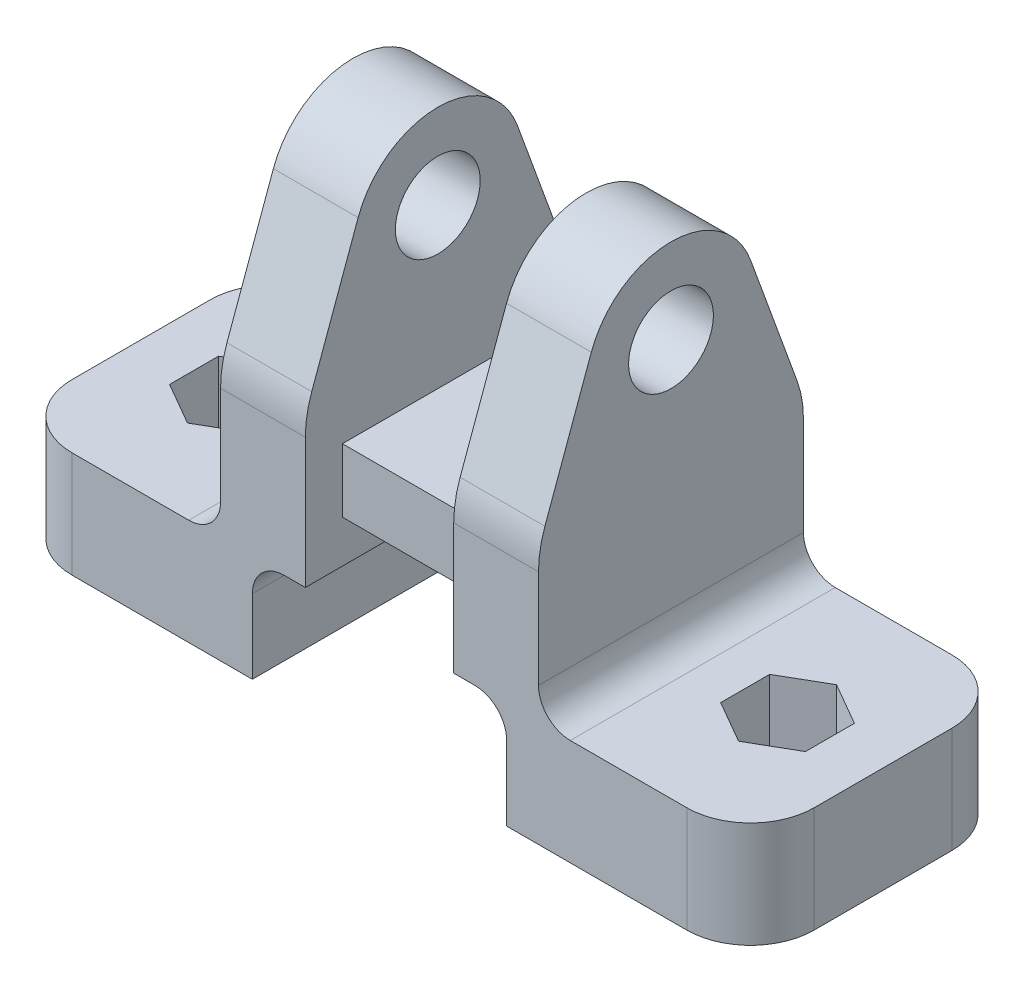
SolidWorks part; units mm, degrees
ref_plane "Alzado" through (0, 0, 0) normal (0, 0, 1) x (1, 0, 0)
ref_plane "Planta" through (0, 0, 0) normal (0, 1, 0) x (1, 0, 0)
ref_plane "Vista lateral" through (0, 0, 0) normal (1, 0, 0) x (0, 0, -1)
sketch "Croquis1" plane through (0, 0, 0) normal (1, 0, 0) x (0, 0, -1)
  line L0 (0, 10) -> (-25, 10)
  line L1 (-25, 10) -> (-25, 24.047)
  line L2 (-25, 24.047) -> (-20.0175, 37.7362)
  line L3 (0, 24.047) -> (0, 10)
  line L4 (0, 24.047) -> (-4.9825, 37.7362)
  arc A1 (-4.9825, 37.7362) -> (-20.0175, 37.7362) centre (-12.5, 35) ccw
  dimension "D1" = 10
  dimension "D3" = 8
  dimension "D2" = 25
  dimension "D4" = 25
  dimension "D5" = 40
extrude "Saliente-Extruir1" add sketch "Croquis1" against normal blind 8 from offset 7
sketch "Croquis2" plane through (0, 10, 0) normal (0, -1, 0) x (1, 0, 0)
  line L0 (-15, 25) -> (-7, 25) construction
  line L1 (-35, 25) -> (-12, 25)
  line L2 (-35, 25) -> (-35, 0)
  line L3 (-35, 0) -> (-12, 0)
  line L4 (-12, 25) -> (-12, 0)
  line L5 (-15, 0) -> (-7, 0) construction
  line L6 (-7, 25) -> (-7, 0) construction
  line L7 (-15, 25) -> (-15, 0) construction
  dimension "D1" = 5
  dimension "D2" = 20
extrude "Saliente-Extruir2" add sketch "Croquis2" along normal blind 10
sketch "Croquis3" plane through (-7, 0, 0) normal (1, 0, 0) x (0, 0, -1)
  line L0 (-25, 10) -> (0, 10) construction
  line L3 (-12.5, 35) -> (-12.5, 17) construction
  line L4 (-21.5, 14) -> (-3.5, 14)
  line L6 (-21.5, 14) -> (-21.5, 20)
  line L7 (-21.5, 20) -> (-3.5, 20)
  line L8 (-3.5, 14) -> (-3.5, 20)
  line L9 (-21.5, 14) -> (-3.5, 20) construction
  line L10 (-21.5, 20) -> (-3.5, 14) construction
  dimension "D2" = 18
  dimension "D3" = 4
  dimension "D1" = 6
extrude "Saliente-Extruir3" add sketch "Croquis3" along normal up to vertex (7 mm away)
hole_wizard "Diámetro de taladro Ø8.0 (8)1" positions "Croquis4" profile "Croquis5" hole size "Ø8.0" standard "ISO"
sketch "Croquis4" plane through (-15, 0, 0) normal (-1, 0, 0) x (0, 0, 1)
  point P0 (12.5, 35)
sketch "Croquis5" plane through (-15, 35, 12.5) normal (0, 1, 0) x (0, 0, 1)
  line L0 (0, 0) -> (0, 15)
  line L1 (0, 15) -> (4, 15)
  line L2 (4, 15) -> (4, 0)
  line L5 (4, 0) -> (0, 0)
  line L11 (0, -6.35) -> (0, 107.95) construction
  dimension "Diámetro de taladro hasta el siguiente" = 8
  dimension "Profundidad de taladro hasta el siguiente" = 15
sketch "Croquis6" plane through (0, 10, 0) normal (0, 1, 0) x (1, 0, 0)
  line L0 (-26, -12.5) -> (-35, -12.5) construction
  line L1 (-30, -10.1906) -> (-30, -14.8094)
  line L2 (-30, -14.8094) -> (-26, -17.1188)
  line L3 (-26, -17.1188) -> (-22, -14.8094)
  line L4 (-22, -14.8094) -> (-22, -10.1906)
  line L5 (-22, -10.1906) -> (-26, -7.8812)
  line L6 (-26, -7.8812) -> (-30, -10.1906)
  line L9 (-35, -25) -> (-35, 0) construction
  circle A0 centre (-26, -12.5) radius 4 construction
  dimension "D1" = 8
  dimension "D2" = 5
extrude "Cortar-Extruir1" cut sketch "Croquis6" against normal through all
fillet "Redondeo1" radius 3 2 edges at (-12, 10, 12.5) (-15, 10, 12.5)
fillet "Redondeo2" radius 6 2 edges at (-35, 5, 0) (-35, 5, 25)
fillet "Redondeo3" radius 10 2 edges at (-11, 24.047, 0) (-11, 24.047, 25)
mirror "Simetría1" about plane through (0, 0, 0) normal (-1, 0, 0)
